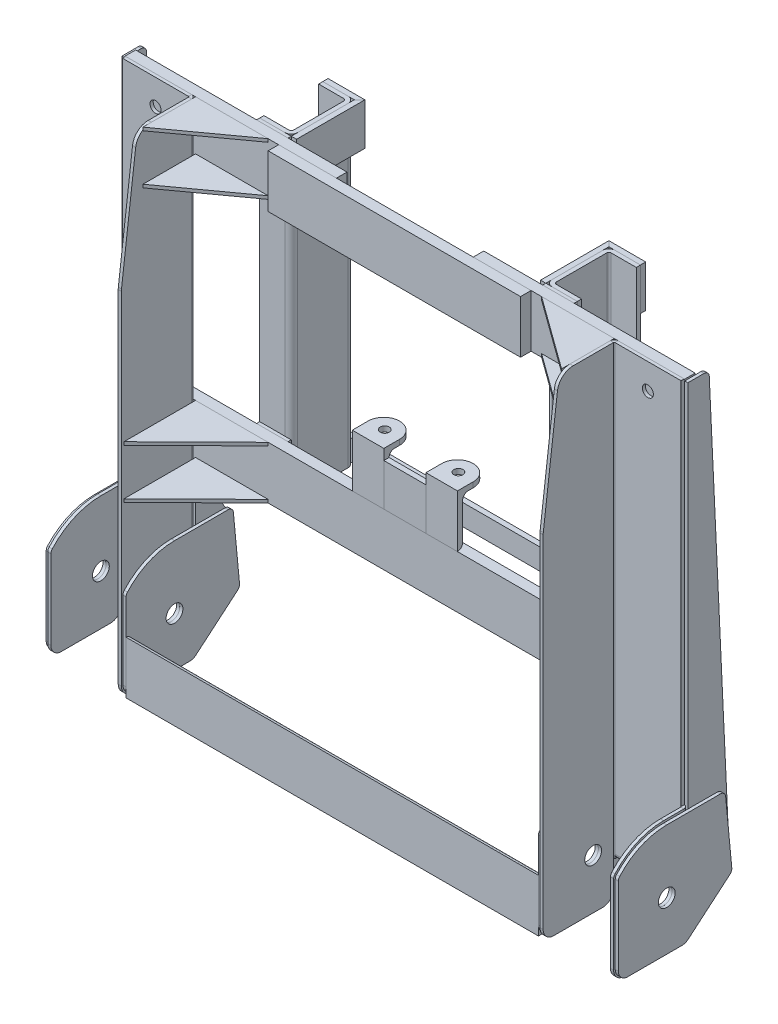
SolidWorks part; units mm, degrees
ref_plane "Plan de face" through (0, 0, 0) normal (0, 0, 1) x (1, 0, 0)
ref_plane "Plan de dessus" through (0, 0, 0) normal (0, 1, 0) x (1, 0, 0)
ref_plane "Plan de droite" through (0, 0, 0) normal (1, 0, 0) x (0, 0, -1)
sketch "Esquisse1" plane through (0, 0, 0) normal (0, 0, 1) x (1, 0, 0)
  line L0 (-266, 0) -> (266, 0)
  dimension "D1" = 532
other "Elément mécano-soudé1"
ref_plane "Plan1" through (-266, 0, 0) normal (1, 0, 0) x (0, 0, -1)
sketch "Esquisse11" plane through (-266, 25, -5) normal (1, 0, 0) x (0, -1, 0)
  line L0 (0, 5) -> (0, -5) construction
  line L1 (-25, 5) -> (25, 5)
  line L2 (-25, 5) -> (-25, -5)
  line L3 (-25, -5) -> (25, -5)
  line L4 (25, 5) -> (25, -5)
  line L5 (-25, 0) -> (25, 0) construction
  point P8 (0, 0)
  dimension "D1" = 50
  dimension "D2" = 10
sketch "Esquisse12" plane through (0, 0, 0) normal (0, 0, 1) x (1, 0, 0)
  line L0 (-266, 250) -> (-65, 250)
  line L1 (65, 250) -> (266, 250)
  line L2 (0, 0) -> (0, 250) construction
  line L3 (-65, 250) -> (65, 250) construction
  line L4 (-266, 0) -> (266, 0) construction
  dimension "D1" = 201
  dimension "D2" = 250
other "Elément mécano-soudé2"
ref_plane "Plan2" through (-266, 250, 0) normal (1, 0, 0) x (0, 0, -1)
sketch "Esquisse14" plane through (-266, 275, -5) normal (1, 0, 0) x (0, -1, 0)
  line L0 (0, 5) -> (0, -5) construction
  line L1 (-25, 5) -> (25, 5)
  line L2 (-25, 5) -> (-25, -5)
  line L3 (-25, -5) -> (25, -5)
  line L4 (25, 5) -> (25, -5)
  line L5 (-25, 0) -> (25, 0) construction
  point P8 (0, 0)
  dimension "D1" = 50
  dimension "D2" = 10
sketch "Esquisse15" plane through (0, 0, 0) normal (0, 0, 1) x (1, 0, 0)
  line L0 (-120, 250) -> (120, 250)
  line L1 (-266, 250) -> (-65, 250) construction
  line L2 (65, 250) -> (266, 250) construction
  dimension "D1" = 240
other "Elément mécano-soudé3"
ref_plane "Plan3" through (120, 250, 0) normal (-1, 0, 0) x (0, 0, 1)
sketch "Esquisse16" plane through (120, 275, 5) normal (-1, 0, 0) x (0, -1, 0)
  line L0 (0, 5) -> (0, -5) construction
  line L1 (-25, 5) -> (25, 5)
  line L2 (-25, 5) -> (-25, -5)
  line L3 (-25, -5) -> (25, -5)
  line L4 (25, 5) -> (25, -5)
  line L5 (-25, 0) -> (25, 0) construction
  point P8 (0, 0)
  dimension "D1" = 50
  dimension "D2" = 10
sketch "Esquisse17" plane through (0, 0, -10) normal (0, 0, -1) x (-1, 0, 0)
  line L0 (151, 300) -> (151, 250)
  line L1 (65, 300) -> (266, 300) construction
  line L2 (151, 50) -> (151, 0)
  line L3 (-266, 50) -> (266, 50) construction
  line L4 (266, 250) -> (266, 300) construction
  line L5 (65, 250) -> (266, 250) construction
  line L6 (-266, 0) -> (266, 0) construction
  dimension "D1" = 115
other "Elément mécano-soudé4"
ref_plane "Plan4" through (-151, 300, -10) normal (0, -1, 0) x (1, 0, 0)
sketch "Esquisse18" plane through (-136, 300, -11.5) normal (0, -1, 0) x (1, 0, 0)
  line L0 (0, 1.5) -> (0, -1.5) construction
  line L1 (-15, 1.5) -> (15, 1.5)
  line L2 (-15, 1.5) -> (-15, -1.5)
  line L3 (-15, -1.5) -> (15, -1.5)
  line L4 (15, 1.5) -> (15, -1.5)
  line L5 (15, 0) -> (-15, 0) construction
  point P8 (0, 0)
  dimension "D1" = 30
  dimension "D2" = 3
sketch "Esquisse19" plane through (0, 0, -13) normal (0, 0, -1) x (-1, 0, 0)
  line L0 (151, 300) -> (151, 0)
other "Elément mécano-soudé5"
ref_plane "Plan5" through (-151, 300, -13) normal (0, -1, 0) x (1, 0, 0)
sketch "Esquisse110" plane through (-121, 300, -43) normal (0, -1, 0) x (-1, 0, 0)
  line L0 (0, 0) -> (54.3278, 0) construction
  line L1 (0, -24) -> (0, 24)
  line L2 (6, 30) -> (30, 30)
  line L3 (30, 30) -> (30, 26)
  line L4 (30, 26) -> (6, 26)
  line L5 (4, 24) -> (4, -24)
  line L6 (30, -26) -> (6, -26)
  line L7 (30, -30) -> (30, -26)
  line L8 (6, -30) -> (30, -30)
  arc A0 (6, 30) -> (0, 24) centre (6, 24) ccw
  arc A1 (6, 26) -> (4, 24) centre (6, 24) ccw
  arc A2 (6, -26) -> (4, -24) centre (6, -24) cw
  arc A3 (6, -30) -> (0, -24) centre (6, -24) cw
  point P17 (4, 0)
  point P19 (0, 30)
  point P20 (0, -30)
  point P21 (0, 0)
  dimension "D5" = 6
  dimension "D1" = 4
  dimension "D3" = 60
  dimension "D4" = 30
sketch "Esquisse111" plane through (0, 300, 0) normal (0, 1, 0) x (-1, 0, 0)
  line L0 (118.5, -13) -> (118.5, -75.5)
  line L1 (118.5, -75.5) -> (151, -75.5)
  line L3 (121, -67) -> (121, -19) construction
  line L4 (151, -73) -> (127, -73) construction
  dimension "D1" = 2.5
  dimension "D2" = 2.5
other "Elément mécano-soudé6"
ref_plane "Plan6" through (-118.5, 300, -13) normal (0, 0, -1) x (-1, 0, 0)
sketch "Esquisse112" plane through (-116, 300, -13) normal (0, 0, -1) x (0, -1, 0)
  line L0 (20, 5) -> (20, 0) construction
  line L1 (0, 0) -> (40, 0)
  line L2 (0, 0) -> (0, 5)
  line L3 (0, 5) -> (40, 5)
  line L4 (40, 0) -> (40, 5)
  line L5 (40, 2.5) -> (0, 2.5) construction
  point P9 (0, 0)
  dimension "D1" = 40
  dimension "D2" = 5
sketch "Esquisse113" plane through (0, 50, 0) normal (0, 1, 0) x (-1, 0, 0)
  line L0 (20, 0) -> (50, 0)
  line L1 (-266, 0) -> (266, 0) construction
  dimension "D1" = 20
  dimension "D2" = 30
other "Elément mécano-soudé7"
ref_plane "Plan7" through (-20, 50, 0) normal (-1, 0, 0) x (0, 0, 1)
sketch "Esquisse114" plane through (-20, 100, 0) normal (-1, 0, 0) x (0, 0, -1)
  line L0 (0, 0) -> (0, 50)
  line L2 (5, 45) -> (5, 10)
  line L3 (10, 5) -> (25, 5)
  line L4 (30, 0) -> (0, 0)
  arc A0 (0, 50) -> (5, 45) centre (0, 45) cw
  arc A1 (5, 10) -> (10, 5) centre (10, 10) ccw
  arc A2 (25, 5) -> (30, 0) centre (25, 0) cw
  point P4 (0, 0)
  dimension "D5" = 5
  dimension "D1" = 50
  dimension "D2" = 30
  dimension "D3" = 5
  dimension "D4" = 5
inserted part "laser fourreau fourche"
move or copy body "Corps-Déplacer/Copier2" placed by mates yes
other "Distance1" parameters "D1"=3
other "<laser fourreau fourche>-<Congé5>"
inserted part "laser renfort axe de fourche"
move or copy body "Corps-Déplacer/Copier4" placed by mates yes
other "<laser renfort axe de fourche>-<Extrusion1>"
inserted part "laser gousset ext. de fourreaux"
move or copy body "Corps-Déplacer/Copier6" placed by mates yes
other "<laser gousset ext. de fourreaux>-<Extrusion1>"
inserted part "laser renfort axe de fourche1"
move or copy body "Corps-Déplacer/Copier8" placed by mates yes
other "<laser renfort axe de fourche>-<Extrusion1>"
inserted part "laser gousset int. de fourreaux"
move or copy body "Corps-Déplacer/Copier10" placed by mates yes
other "<laser gousset int. de fourreaux>-<Extrusion1>"
inserted part "laser gousset renfort de fourreaux haut"
move or copy body "Corps-Déplacer/Copier12" placed by mates yes
other "<laser gousset renfort de fourreaux haut>-<Extrusion1>"
inserted part "laser gousset renfort de fourreaux haut1"
move or copy body "Corps-Déplacer/Copier14" placed by mates yes
other "<laser gousset renfort de fourreaux haut>-<Extrusion1>"
inserted part "laser gousset renfort de fourreaux bas"
move or copy body "Corps-Déplacer/Copier16" placed by mates yes
other "<laser gousset renfort de fourreaux bas>-<Extrusion1>"
inserted part "laser gousset renfort de fourreaux bas1"
move or copy body "Corps-Déplacer/Copier18" placed by mates yes
other "<laser gousset renfort de fourreaux bas>-<Extrusion1>"
sketch "Esquisse115" plane through (0, 100, 0) normal (0, 1, 0) x (-1, 0, 0)
  line L0 (50, 0) -> (20, 0) construction
  line L1 (20, 0) -> (20, -30) construction
  circle A0 centre (35, -15.9) radius 4.3121
  dimension "D1" = 15.9
  dimension "D2" = 15
extrude "Enlèv. mat.-Extru.1" cut sketch "Esquisse115" against normal through all
sketch "Esquisse116" plane through (0, 100, 0) normal (0, 1, 0) x (-1, 0, 0)
  line L0 (50, -15) -> (50, -30)
  line L1 (50, 0) -> (50, -30) construction
  line L2 (50, -30) -> (35, -30)
  line L3 (50, -30) -> (20, -30) construction
  arc A0 (35, -30) -> (50, -15) centre (35, -15) ccw
  dimension "D1" = 15
extrude "Enlèv. mat.-Extru.2" cut sketch "Esquisse116" against normal through all
sketch "Esquisse117" plane through (0, 100, 0) normal (0, 1, 0) x (-1, 0, 0)
  line L0 (35, -30) -> (20, -30)
  line L1 (35, -30) -> (20, -30) construction
  line L2 (20, -30) -> (20, -15)
  line L3 (20, 0) -> (20, -30) construction
  arc A0 (20, -15) -> (35, -30) centre (35, -15) ccw
  dimension "D1" = 15
extrude "Enlèv. mat.-Extru.3" cut sketch "Esquisse117" against normal through all
mirror "Symétrie1" about plane through (0, 0, 0) normal (1, 0, 0)
sketch "Esquisse118" plane through (0, 50, 0) normal (0, 1, 0) x (-1, 0, 0)
  line L0 (20, 0) -> (-20, 0)
  line L1 (-266, 0) -> (266, 0) construction
  line L2 (-50, 0) -> (-20, 0) construction
other "Elément mécano-soudé8"
ref_plane "Plan8" through (-20, 50, 0) normal (1, 0, 0) x (0, 0, -1)
sketch "Esquisse119" plane through (-20, 90, 0) normal (1, 0, 0) x (0, -1, 0)
  line L0 (20, 5) -> (20, 0) construction
  line L1 (0, 0) -> (40, 0)
  line L2 (0, 0) -> (0, 5)
  line L3 (0, 5) -> (40, 5)
  line L4 (40, 0) -> (40, 5)
  line L5 (40, 2.5) -> (0, 2.5) construction
  point P9 (0, 0)
  dimension "D1" = 40
  dimension "D2" = 5
sketch "Esquisse120" plane through (0, 0, -73) normal (0, 0, -1) x (-1, 0, 0)
  line L0 (-138, 0) -> (138, 0)
  line L1 (-151, 0) -> (-127, 0) construction
  line L2 (151, 0) -> (127, 0) construction
  dimension "D1" = 276
other "Elément mécano-soudé9"
ref_plane "Plan9" through (138, 0, -73) normal (-1, 0, 0) x (0, 0, 1)
sketch "Esquisse121" plane through (138, 10, -75.5) normal (-1, 0, 0) x (0, -1, 0)
  line L0 (0, 2.5) -> (0, -2.5) construction
  line L1 (-10, 2.5) -> (10, 2.5)
  line L2 (-10, 2.5) -> (-10, -2.5)
  line L3 (-10, -2.5) -> (10, -2.5)
  line L4 (10, 2.5) -> (10, -2.5)
  line L5 (-10, 0) -> (10, 0) construction
  point P8 (0, 0)
  dimension "D1" = 5
  dimension "D2" = 20
sketch "Esquisse122" plane through (0, 0, 69) normal (0, 0, 1) x (1, 0, 0)
  line L0 (196, -109) -> (-196, -109)
  line L1 (196, -75.8394) -> (196, -150) construction
  line L2 (-196, -75.8394) -> (-196, -150) construction
  dimension "D1" = 50
other "Elément mécano-soudé10"
ref_plane "Plan10" through (196, -109, 69) normal (-1, 0, 0) x (0, 0, 1)
sketch "Esquisse123" plane through (196, -159, 69) normal (-1, 0, 0) x (0, 1, 0)
  line L0 (0, 0) -> (50, 0)
  line L1 (45, 5) -> (10, 5)
  line L2 (5, 10) -> (5, 45)
  line L3 (0, 50) -> (0, 0)
  arc A0 (50, 0) -> (45, 5) centre (45, 0) ccw
  arc A1 (10, 5) -> (5, 10) centre (10, 10) cw
  arc A2 (5, 45) -> (0, 50) centre (0, 45) ccw
  point P11 (0, 0)
  dimension "D5" = 5
  dimension "D1" = 50
  dimension "D2" = 50
  dimension "D3" = 5
  dimension "D4" = 5
